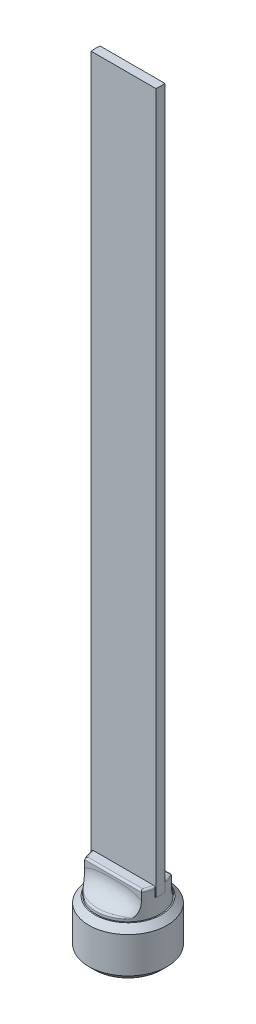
SolidWorks part; units mm, degrees
ref_plane "Front Plane" through (0, 0, 0) normal (0, 0, 1) x (1, 0, 0)
ref_plane "Top Plane" through (0, 0, 0) normal (0, 1, 0) x (1, 0, 0)
ref_plane "Right Plane" through (0, 0, 0) normal (1, 0, 0) x (0, 0, -1)
imported_body "Imported1"
sketch "Sketch1" plane through (0, 17.145, 0) normal (0, 1, 0) x (1, 0, 0)
  line L0 (-8.5916, 1.1938) -> (8.5916, 1.1938)
  line L1 (8.4248, 1.1938) -> (-8.4248, 1.1938) construction
  line L2 (-8.4248, -1.1938) -> (8.4248, -1.1938) construction
  line L3 (8.5916, -1.1938) -> (-8.5916, -1.1938)
  arc A0 (-8.5916, 1.1938) -> (-8.5916, -1.1938) centre (0, 0) ccw
  arc A1 (8.5916, -1.1938) -> (8.5916, 1.1938) centre (0, 0) ccw
  dimension "D1" = 17.3482
extrude "Boss-Extrude1" add sketch "Sketch1" along normal offset from surface (186.055 mm away) 203.2
